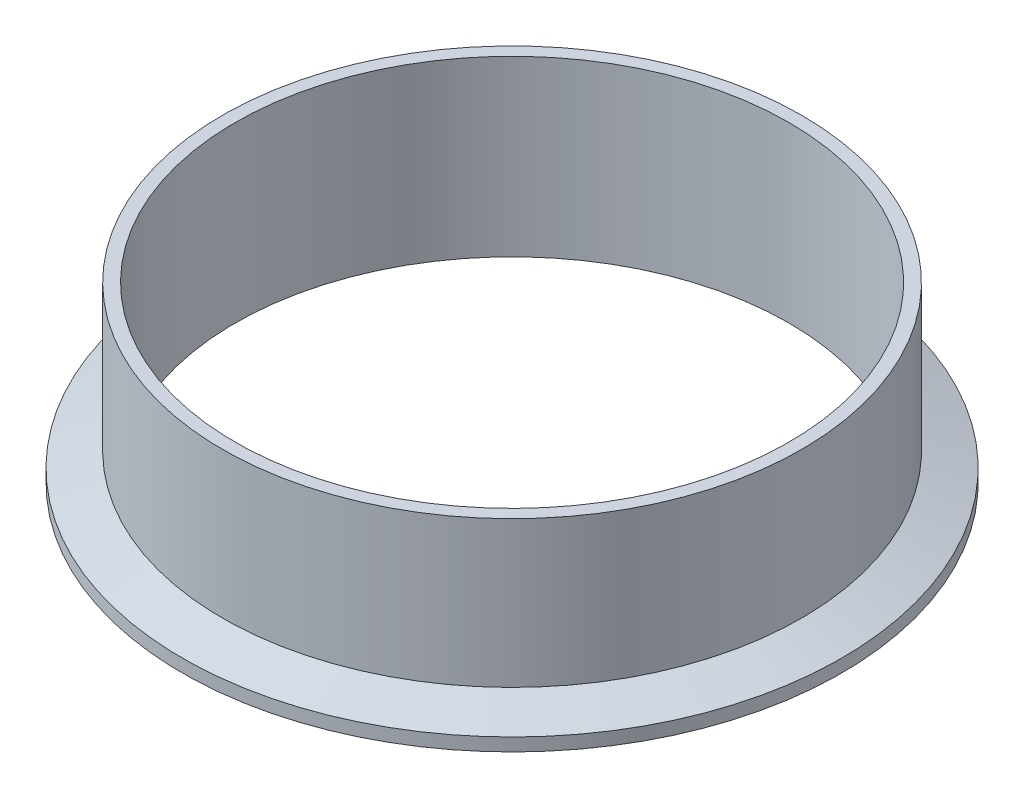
SolidWorks part; units mm, degrees
ref_plane "Front Plane" through (0, 0, 0) normal (0, 0, 1) x (1, 0, 0)
ref_plane "Top Plane" through (0, 0, 0) normal (0, 1, 0) x (1, 0, 0)
ref_plane "Right Plane" through (0, 0, 0) normal (1, 0, 0) x (0, 0, -1)
sketch "Sketch1" plane through (0, 0, 0) normal (0, 0, 1) x (1, 0, 0)
  line L0 (0, 0) -> (0, 38.1) construction
  line L1 (0, 38.1) -> (-63.5, 38.1)
  line L2 (-63.5, 38.1) -> (-63.5, 6.0435)
  line L3 (-63.5, 6.0435) -> (-72.2884, 2.8448)
  line L4 (-72.2884, 2.8448) -> (-72.2884, 0)
  line L5 (-72.2884, 0) -> (-69.2804, 0)
  line L6 (-65.6444, 0) -> (0, 0)
  line L7 (0, 0) -> (0, 38.1)
  line L8 (0, 38.1) -> (-60.7314, 38.1)
  line L9 (-60.7314, 38.1) -> (-60.7314, 0)
  line L10 (-60.7314, 0) -> (0, 0)
  line L11 (0, 0) -> (-0.1846, 0.0129)
  arc A0 (-68.5579, 0.4745) -> (-66.3669, 0.4745) centre (-67.4624, 0) cw
  arc A1 (-65.6444, 0) -> (-66.3669, 0.4745) centre (-65.6444, 0.7874) cw
  arc A2 (-68.5579, 0.4745) -> (-69.2804, 0) centre (-69.2804, 0.7874) cw
  point P12 (-66.2686, 0)
  dimension "D6" = 1.1938
  dimension "D7" = 0.7874
  dimension "D1" = 63.5
  dimension "D2" = 2.8448
  dimension "D3" = 72.2884
  dimension "D4" = 70
  dimension "D5" = 67.4624
  dimension "D8" = 2.7686
  dimension "D9" = 38.1
revolve "Revolve2" add sketch "Sketch1" angle 360 about L0
